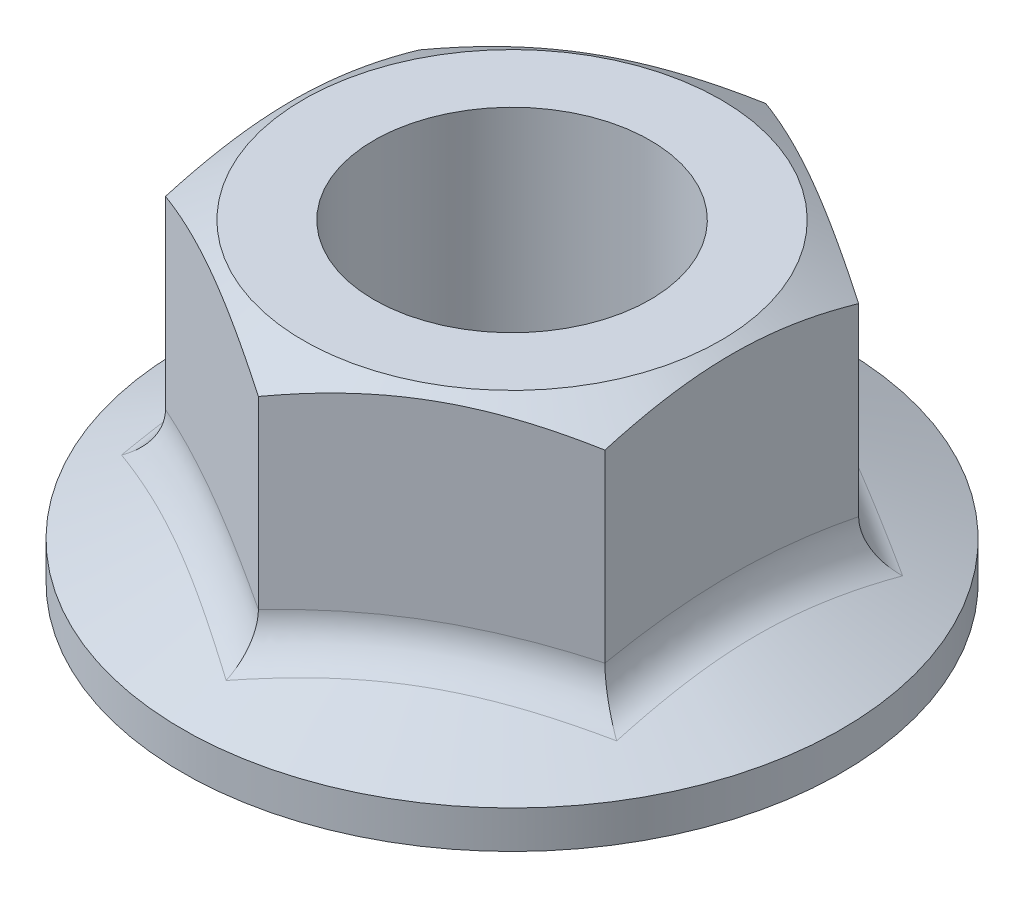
SolidWorks part; units mm, degrees
ref_plane "Front Plane" through (0, 0, 0) normal (0, 0, 1) x (1, 0, 0)
ref_plane "Top Plane" through (0, 0, 0) normal (0, 1, 0) x (1, 0, 0)
ref_plane "Right Plane" through (0, 0, 0) normal (1, 0, 0) x (0, 0, -1)
other "Configuration Table"
sketch "BaseNutSke" plane through (0, 0, 0) normal (0, 1, 0) x (1, 0, 0)
  line L1 (0, 8.0829) -> (-7, 4.0415)
  line L2 (-7, 4.0415) -> (-7, -4.0415)
  line L3 (-7, -4.0415) -> (0, -8.0829)
  line L4 (0, -8.0829) -> (7, -4.0415)
  line L5 (7, -4.0415) -> (7, 4.0415)
  line L6 (7, 4.0415) -> (0, 8.0829)
  circle A0 centre (0, 0) radius 7 construction
extrude "BaseNut" add sketch "BaseNutSke" along normal blind 10
sketch "FlangeSke" plane through (0, 0, 0) normal (1, 0, 0) x (0, 0, -1)
  line L0 (0, 0) -> (10.5, 0)
  line L1 (10.5, 0) -> (10.5, 1.2)
  line L2 (10.5, 1.2) -> (4.0415, 4.2117)
  line L3 (4.0415, 4.2117) -> (0, 4.2117)
  line L4 (0, 4.2117) -> (0, 0)
  line L5 (0, 0) -> (0, 18.4813) construction
  dimension "Flange_diameter" = 21
  dimension "Ang" = 25
  dimension "Flange_thickness" = 1.2
revolve "Flange" add sketch "FlangeSke" angle 360 about L5
sketch "HoleSke" plane through (0, 0, 0) normal (0, 1, 0) x (1, 0, 0)
  circle A0 centre (0, 0) radius 5 construction
  circle A1 centre (0, 0) radius 4.4
extrude "TappedHole" cut sketch "HoleSke" along normal through all
sketch "CutChamferSke" plane through (0, 0, 0) normal (1, 0, 0) x (0, 0, -1)
  line L0 (6.65, 10) -> (8.0829, 10)
  line L1 (8.0829, 10) -> (8.0829, 9.1727)
  line L2 (8.0829, 9.1727) -> (6.65, 10)
  line L3 (0, 0) -> (0, 18.9818) construction
revolve "CutChamfer" cut sketch "CutChamferSke" angle 360 about L3
fillet "Fillet" radius 1.4 6 edges at (5.1284, 2.7164, 5.122) (-1.8716, 2.7164, 7.0024) (-5.1284, 2.7164, -5.122) (1.8716, 2.7164, -7.0024)
sketch "ThdSchSke" plane through (0, 0, 0) normal (1, 0, 0) x (0, 0, -1)
  line L0 (0, -18.1994) -> (0, 18.1994) construction
  line L1 (-3.7072, 0.3464) -> (-3.7072, -0.3464)
  line L2 (-3.7072, -0.3464) -> (-4.4, -0.3464)
  line L3 (-4.4, -0.3464) -> (-5, 0)
  line L4 (-5, 0) -> (-4.4, 0.3464)
  line L5 (-4.4, 0.3464) -> (-3.7072, 0.3464)
revolve "ThreadSchematic" [suppressed] cut sketch "ThdSchSke" angle 360 about L0
pattern_linear "ThdSchPat" [suppressed] count 9 along (0, 1, 0)
equation "\"D2@ThreadCosmetic\" = \"Diameter@HoleSke\""
equation "\"D2@CutChamferSke\" = \"Width@BaseNutSke\"*0.95"
equation "\"D2@ThdSchSke\" = \"Tap_drill@HoleSke\""
equation "\"D1@ThdSchSke\" = \"Diameter@HoleSke\""
equation "\"D1@ThdSchPat\" =  int( \"Height@BaseNut\" / \"Advance@ThdSchPat\" ) +1"
